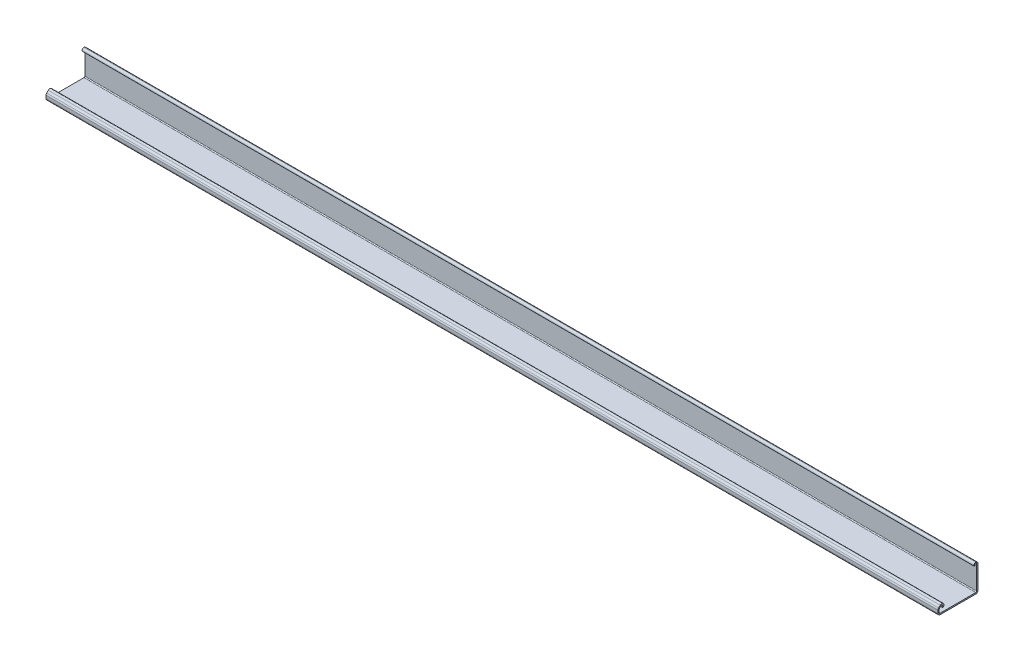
SolidWorks part; units mm, degrees
ref_plane "Front Plane" through (0, 0, 0) normal (0, 0, 1) x (1, 0, 0)
ref_plane "Top Plane" through (0, 0, 0) normal (0, 1, 0) x (1, 0, 0)
ref_plane "Right Plane" through (0, 0, 0) normal (1, 0, 0) x (0, 0, -1)
sketch "Sketch1" plane through (0, 0, 0) normal (0, 0, 1) x (1, 0, 0)
  line L0 (0, 0) -> (1000, 0)
  dimension "D1" = 1000
other "Muut profiilit 1.0057 LINEAARIN PEITEPROFIILI 12(1)"
ref_plane "Plane1" through (0, 0, 0) normal (1, 0, 0) x (0, 1, 0)
sketch "Sketch19" plane through (0, 0, 0) normal (1, 0, 0) x (0, 1, 0)
  line L0 (-6.105, 19.9674) -> (-7.9054, 21.7678)
  line L1 (-9.6732, 22.5) -> (-12.8728, 22.5)
  line L2 (-15.3728, 20) -> (-15.3728, -20)
  line L3 (-12.8728, -22.5) -> (13.1272, -22.5)
  line L4 (13.6272, -21) -> (-12.8728, -21)
  line L5 (-13.8728, -20) -> (-13.8728, 20)
  line L6 (-12.8728, 21) -> (-9.6732, 21)
  line L7 (-8.966, 20.7071) -> (-7.1657, 18.9067)
  arc A0 (-5.3728, 18.1996) -> (-6.105, 19.9674) centre (-7.8728, 18.1996) ccw
  arc A1 (-7.9054, 21.7678) -> (-9.6732, 22.5) centre (-9.6732, 20) ccw
  arc A2 (-12.8728, 22.5) -> (-15.3728, 20) centre (-12.8728, 20) ccw
  arc A3 (-15.3728, -20) -> (-12.8728, -22.5) centre (-12.8728, -20) ccw
  arc A4 (13.1272, -22.5) -> (15.6272, -20) centre (13.1272, -20) ccw
  arc A5 (15.6272, -20) -> (12.6526, -18.2535) centre (13.6272, -20) ccw
  arc A6 (12.6526, -18.2535) -> (13.1399, -19.1268) centre (12.8963, -18.6902) ccw
  arc A7 (14.6272, -20) -> (13.1399, -19.1268) centre (13.6272, -20) ccw
  arc A8 (13.6272, -21) -> (14.6272, -20) centre (13.6272, -20) ccw
  arc A9 (-13.8728, -20) -> (-12.8728, -21) centre (-12.8728, -20) ccw
  arc A10 (-12.8728, 21) -> (-13.8728, 20) centre (-12.8728, 20) ccw
  arc A11 (-8.966, 20.7071) -> (-9.6732, 21) centre (-9.6732, 20) ccw
  arc A12 (-6.8728, 18.1996) -> (-7.1657, 18.9067) centre (-7.8728, 18.1996) ccw
  arc A13 (-8.5799, 17.4925) -> (-6.8728, 18.1996) centre (-7.8728, 18.1996) ccw
  arc A14 (-8.5799, 17.4925) -> (-9.6406, 16.4319) centre (-9.1102, 16.9622) ccw
  arc A15 (-9.6406, 16.4319) -> (-5.3728, 18.1996) centre (-7.8728, 18.1996) ccw
  point P40 (0, 0)
